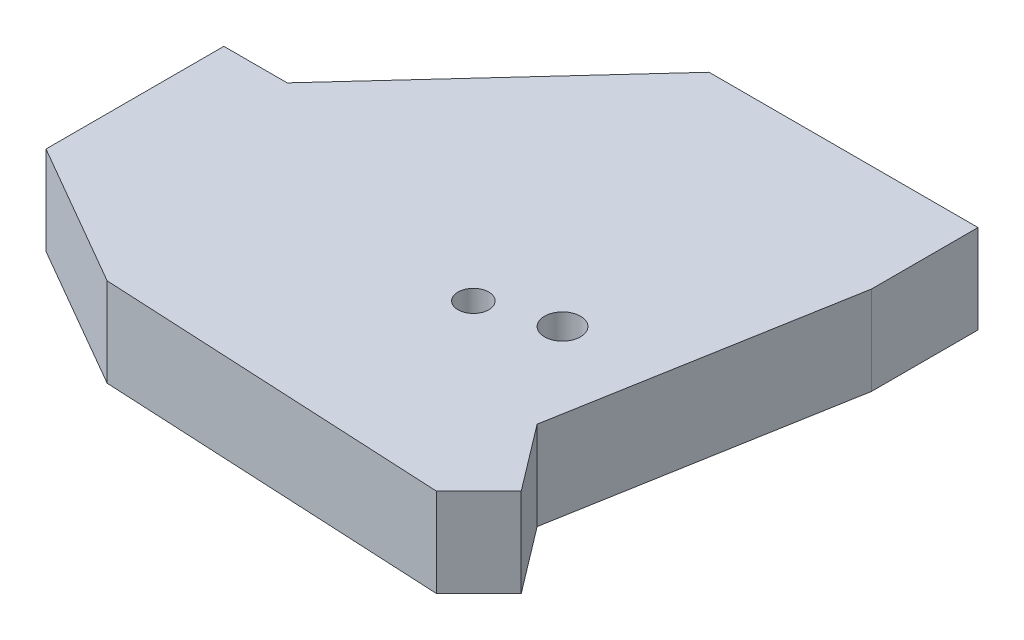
SolidWorks part; units mm, degrees
ref_plane "Front" through (0, 0, 0) normal (0, 0, 1) x (1, 0, 0)
ref_plane "Top" through (0, 0, 0) normal (0, 1, 0) x (1, 0, 0)
ref_plane "Right" through (0, 0, 0) normal (1, 0, 0) x (0, 0, -1)
sketch "Sketch2" plane through (0, 0, 0) normal (0, 1, 0) x (1, 0, 0)
  line L0 (0, 0) -> (0, 866.0363)
  line L1 (0, 866.0363) -> (308.3528, 866.0363)
  line L2 (308.3528, 866.0363) -> (1290.5175, 1937.881)
  line L3 (1290.5175, 1937.881) -> (2600, 1937.881)
  line L4 (2600, 1937.881) -> (2600, 1419.3599)
  line L5 (2600, 1419.3599) -> (2355.9513, 35.291)
  line L6 (2355.9513, 35.291) -> (2599.9789, -286.2034)
  line L7 (2599.9789, -286.2034) -> (2394.0473, -492.1351)
  line L8 (2394.0473, -492.1351) -> (704.6337, -406.8487)
  line L9 (704.6337, -406.8487) -> (0, 0)
  circle A0 centre (2006, 508.881) radius 87.5
  circle A1 centre (1681, 399.881) radius 75
  dimension "D1" = 594
  dimension "D2" = 1429
  dimension "D3" = 1538
  dimension "D4" = 919
sketch "Sketch4" plane through (0, 0, 0) normal (0, 1, 0) x (1, 0, 0)
  line L0 (0, 0) -> (0, 866.0363)
  line L1 (0, 866.0363) -> (308.3528, 866.0363)
  line L2 (308.3528, 866.0363) -> (1290.5175, 1937.881)
  line L3 (1290.5175, 1937.881) -> (2600, 1937.881)
  line L4 (2600, 1937.881) -> (2600, 1419.3599)
  line L5 (2600, 1419.3599) -> (2355.9513, 35.291)
  line L6 (2355.9513, 35.291) -> (2599.9789, -286.2034)
  line L7 (2599.9789, -286.2034) -> (2394.0473, -492.1351)
  line L8 (2394.0473, -492.1351) -> (704.6337, -406.8487)
  line L9 (704.6337, -406.8487) -> (0, 0)
  circle A0 centre (2006, 508.881) radius 87.5
  circle A1 centre (1681, 399.881) radius 75
extrude "Extrude2" add sketch "Sketch4" along normal blind 432
ref_plane "Plane1" through (1290.5175, 432, -1937.881) normal (0, -1, 0) x (1, 0, 0)
sketch "Sketch5" plane through (1290.5175, 432, -1937.881) normal (0, -1, 0) x (1, 0, 0)
  line L0 (0, 0) -> (1309.4825, 0)
  line L1 (1309.4825, 518.5211) -> (1309.4825, 0) construction
